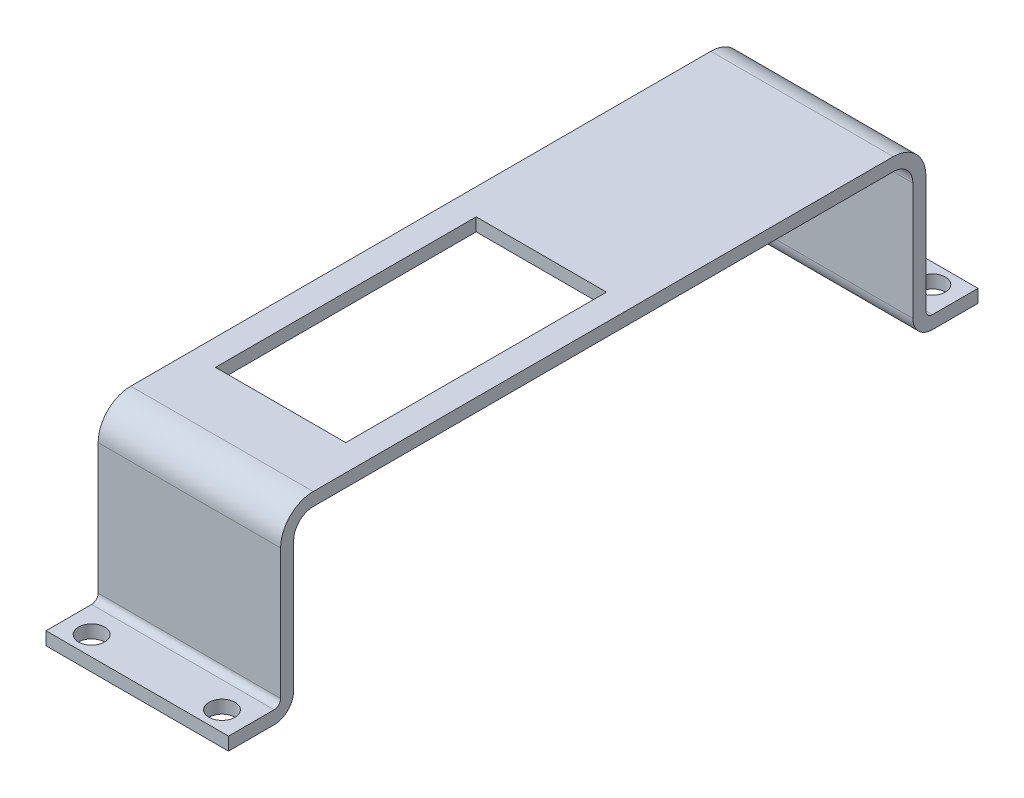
SolidWorks part; units mm, degrees
ref_plane "Front Plane" through (0, 0, 0) normal (0, 0, 1) x (1, 0, 0)
ref_plane "Top Plane" through (0, 0, 0) normal (0, 1, 0) x (1, 0, 0)
ref_plane "Right Plane" through (0, 0, 0) normal (1, 0, 0) x (0, 0, -1)
sketch "Sketch1" plane through (0, 0, 0) normal (1, 0, 0) x (0, 0, -1)
  line L0 (3, 0) -> (10, 0)
  line L2 (-3, 24) -> (-92, 24)
  line L3 (-95, 21) -> (-95, 1)
  line L4 (-98, -2) -> (-105, -2)
  line L5 (0, 21) -> (0, 3)
  line L6 (2, 21) -> (2, 3)
  line L7 (-3, 26) -> (-92, 26)
  line L8 (-97, 21) -> (-97, 1)
  line L9 (-98, 0) -> (-105, 0)
  line L10 (3, 2) -> (10, 2)
  line L11 (10, 2) -> (10, 0)
  line L12 (-105, 0) -> (-105, -2)
  arc A0 (-3, 24) -> (0, 21) centre (-3, 21) cw
  arc A1 (-92, 24) -> (-95, 21) centre (-92, 21) ccw
  arc A2 (-95, 1) -> (-98, -2) centre (-98, 1) cw
  arc A3 (0, 3) -> (3, 0) centre (3, 3) ccw
  arc A4 (2, 3) -> (3, 2) centre (3, 3) ccw
  arc A5 (-3, 26) -> (2, 21) centre (-3, 21) cw
  arc A6 (-92, 26) -> (-97, 21) centre (-92, 21) ccw
  arc A7 (-97, 1) -> (-98, 0) centre (-98, 1) cw
  point P9 (0, 24)
  point P14 (-95, -2)
  dimension "D6" = 3
  dimension "D7" = 2
  dimension "D1" = 3
  dimension "D2" = 95
  dimension "D3" = 10
  dimension "D4" = 10
  dimension "D5" = 24
  dimension "D8" = 2
extrude "Boss-Extrude1" add sketch "Sketch1" along normal mid plane 28
sketch "Sketch2" plane through (0, 26, 0) normal (0, 1, 0) x (1, 0, 0)
  line L0 (0, 0) -> (0, -109.3837) construction
  line L1 (-10, -43) -> (10, -43)
  line L2 (-10, -43) -> (-10, -83)
  line L3 (-10, -83) -> (10, -83)
  line L4 (10, -43) -> (10, -83)
  line L5 (14, -97) -> (-14, -97) construction
  dimension "D1" = 14
  dimension "D2" = 20
  dimension "D3" = 40
  dimension "D4" = 10
extrude "Cut-Extrude1" cut sketch "Sketch2" against normal through all
sketch "Sketch3" plane through (0, 0, 0) normal (0, 1, 0) x (1, 0, 0)
  line L0 (0, 0) -> (0, -109.973) construction
  line L1 (14, -98) -> (14, -105) construction
  line L2 (14, -105) -> (-14, -105) construction
  line L3 (-14, -98) -> (-14, -105) construction
  circle A0 centre (10, -102) radius 2
  circle A1 centre (-10, -102) radius 2
  point P7 (14, -101.5)
  dimension "D1" = 4
  dimension "D2" = 4
  dimension "D5" = 4
  dimension "D3" = 4
  dimension "D4" = 3
  dimension "D6" = 3
extrude "Cut-Extrude2" cut sketch "Sketch3" against normal through all
sketch "Sketch4" plane through (0, 2, 0) normal (0, 1, 0) x (1, 0, 0)
  line L0 (0, 0) -> (0, 13.9416) construction
  line L1 (14, 10) -> (-14, 10) construction
  line L2 (14, 10) -> (14, 3) construction
  line L3 (-14, 10) -> (-14, 3) construction
  circle A0 centre (10, 7) radius 2
  circle A1 centre (-10, 7) radius 2
  point P9 (14, 6.5)
  dimension "D1" = 4
  dimension "D2" = 4
  dimension "D3" = 3
  dimension "D4" = 3
  dimension "D5" = 4
  dimension "D6" = 4
extrude "Cut-Extrude3" cut sketch "Sketch4" against normal through all
